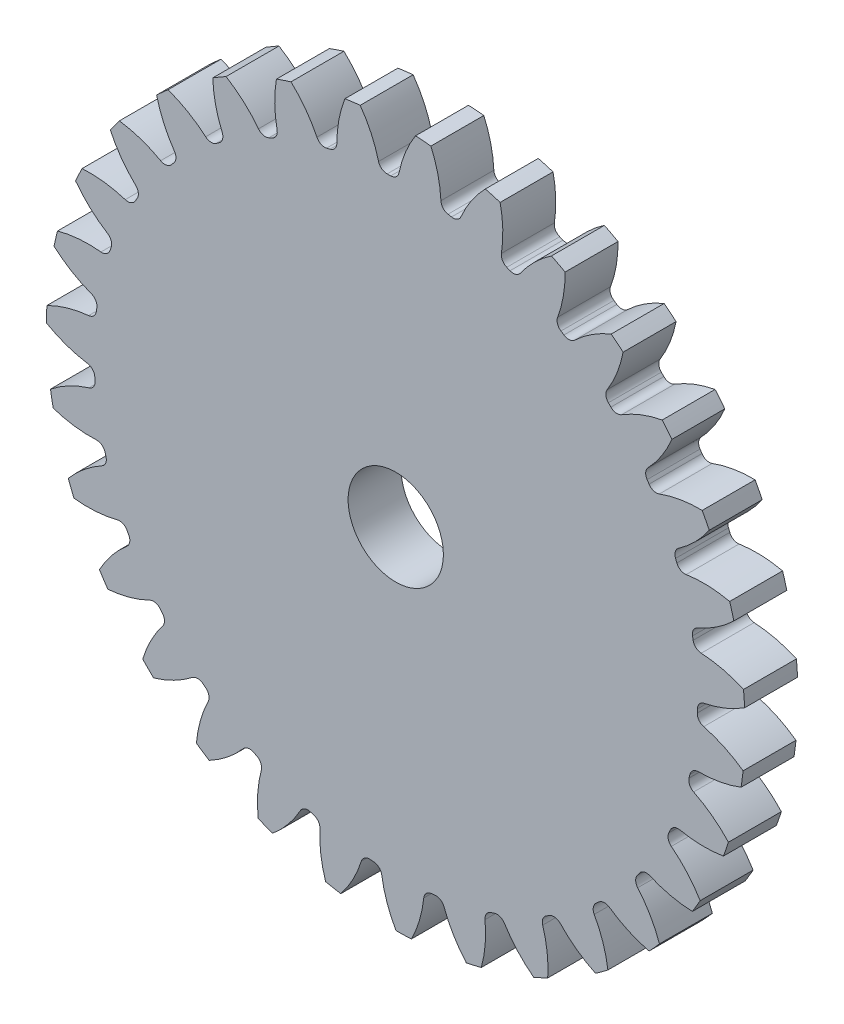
SolidWorks part; units mm, degrees
ref_plane "Front" through (0, 0, 0) normal (0, 0, 1) x (1, 0, 0)
ref_plane "Top" through (0, 0, 0) normal (0, 1, 0) x (1, 0, 0)
ref_plane "Right" through (0, 0, 0) normal (1, 0, 0) x (0, 0, -1)
sketch "Sketch3" plane through (0, 0, 0) normal (0, 0, 1) x (1, 0, 0)
  circle A0 centre (0, 0) radius 838.2
  dimension "od" = 1676.4
extrude "gearBody" add sketch "Sketch3" along normal blind 127
sketch "Sketch2" plane through (0, 0, 0) normal (0, 0, 1) x (1, 0, 0)
  line L0 (0, 0) -> (683.5914, 283.1528) construction
  line L1 (834.4368, -90.5685) -> (0, 0) construction
  line L2 (0, 0) -> (36.3143, 0) construction
  line L3 (787.2031, 17.6073) -> (784.9807, -61.6774) construction
  line L5 (786.0919, -22.035) -> (0, 0) construction
  line L7 (0, 0) -> (739.914, 0) construction
  arc A0 (739.9046, 3.7273) -> (738.5339, -45.1696) centre (0, 0) ccw construction
  arc A1 (837.0976, 42.9745) -> (833.3758, -89.7997) centre (0, 0) ccw construction
  arc A2 (787.2031, 17.6073) -> (784.9807, -61.6774) centre (0, 0) ccw construction
  arc A3 (723.4831, -24.5648) -> (723.7231, -16.002) centre (0, 0) ccw
  arc A4 (834.4368, -90.5685) -> (738.9061, -45.2668) centre (666.6563, -321.0017) ccw
  arc A5 (834.4368, -90.5685) -> (838.2, 43.6826) centre (0, 0) ccw
  arc A6 (838.2, 43.6826) -> (740.2816, 3.8036) centre (683.5914, 283.1528) cw
  arc A7 (723.7231, -16.002) -> (740.2816, 3.8036) centre (744.3937, -16.459) cw
  arc A8 (738.9061, -45.2668) -> (723.4831, -24.5648) centre (744.1468, -25.2664) cw
  point P6 (838.2, 43.6826)
  point P22 (834.4368, -90.5685)
  dimension "baseDia" = 1479.8279
  dimension "od" = 1676.4
  dimension "pd" = 1574.8
  dimension "rd" = 1447.8
  dimension "rFillet" = 20.6756
  dimension "pointX" = 838.2
  dimension "pointY" = 43.6826
  dimension "CTT" = 79.2847
  dimension "flankCenterAngle" = 22.5
extrude "toothCut" cut sketch "Sketch2" along normal through all
pattern_circular "CirPattern1" count 31 over 360 about axis through (0, 0, 0) along (0, 0, 1) of "toothCut"
sketch "hub1Dia" plane through (0, 0, 0) normal (0, 0, -1) x (-1, 0, 0)
  circle A0 centre (0, 0) radius 12.7
  dimension "hub1Dia" = 25.4
sketch "hub2Dia" plane through (0, 0, 127) normal (0, 0, 1) x (1, 0, 0)
  circle A0 centre (0, 0) radius 12.7
  dimension "hub2dia" = 25.4
sketch "boreDia" plane through (0, 0, 0) normal (0, 0, 1) x (1, 0, 0)
  circle A0 centre (0, 0) radius 114.3
  dimension "boreDia" = 228.6
extrude "bore" cut sketch "boreDia" against normal mid plane 25400
